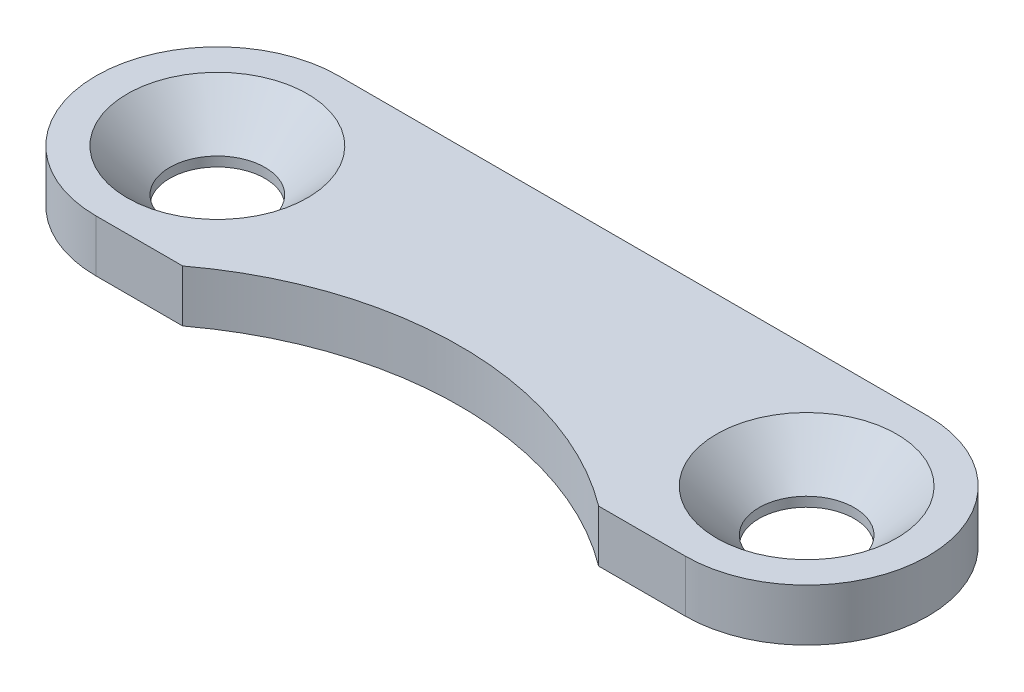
SolidWorks part; units mm, degrees
ref_plane "Front Plane" through (0, 0, 0) normal (0, 0, 1) x (1, 0, 0)
ref_plane "Top Plane" through (0, 0, 0) normal (0, 1, 0) x (1, 0, 0)
ref_plane "Right Plane" through (0, 0, 0) normal (1, 0, 0) x (0, 0, -1)
sketch "Sketch1" plane through (0, 0, 0) normal (0, 1, 0) x (1, 0, 0)
  line L0 (-17, 0) -> (17, 0) construction
  line L1 (0, 0) -> (0, -27.0027) construction
  line L2 (-17, 7) -> (17, 7)
  line L3 (17, -7) -> (12, -7)
  line L4 (-12, -7) -> (-17, -7)
  arc A0 (-17, 7) -> (-17, -7) centre (-17, 0) ccw
  arc A1 (17, -7) -> (17, 7) centre (17, 0) ccw
  arc A2 (12, -7) -> (-12, -7) centre (0, -23) ccw
  dimension "D3" = 14
  dimension "D4" = 14
  dimension "D5" = 40
  dimension "D6" = 23
  dimension "D1" = 17
  dimension "D2" = 17
  dimension "D7" = 7
extrude "Extrude1" add sketch "Sketch1" along normal blind 3
sketch "Sketch2" plane through (0, 3, 0) normal (0, 1, 0) x (1, 0, 0)
  point P0 (17, 0)
  point P1 (-17, 0)
hole_wizard "CSK for M5 Countersunk Flat Head Screw1" positions "3DSketch1" profile "Sketch4" countersink size "M5" standard "ISO"
sketch3d "3DSketch1"
  point P0 (-17, 3, 0)
  point P3 (17, 3, 0)
sketch "Sketch4" plane through (-17, 3, 0) normal (1, 0, 0) x (0, 0, 1)
  line L0 (0, 0) -> (0, 3)
  line L1 (0, 3) -> (2.75, 3)
  line L2 (2.75, 3) -> (2.75, 2.45)
  line L3 (2.75, 2.45) -> (5.2, 0)
  line L5 (5.2, 0) -> (0, 0)
  line L6 (-2.75, 2.45) -> (-5.2, 0) construction
  line L11 (0, -6.35) -> (0, 107.95) construction
  dimension "Thru Hole Dia." = 5.5
  dimension "Thru Hole Depth" = 3
  dimension "Near C'Sink Dia." = 10.4
  dimension "Near C'Sink Angle" = 90
